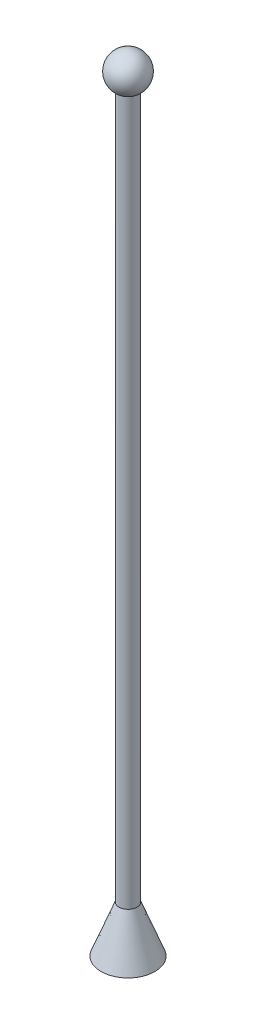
SolidWorks part; units mm, degrees
ref_plane "Front Plane" through (0, 0, 0) normal (0, 0, 1) x (1, 0, 0)
ref_plane "Top Plane" through (0, 0, 0) normal (0, 1, 0) x (1, 0, 0)
ref_plane "Right Plane" through (0, 0, 0) normal (1, 0, 0) x (0, 0, -1)
sketch "Sketch1" plane through (0, 0, 0) normal (0, 1, 0) x (1, 0, 0)
  circle A0 centre (0, 0) radius 19.05
  dimension "D1" = 38.1
ref_plane "Plane1" through (0, 33.02, 0) normal (0, 1, 0) x (-1, 0, 0)
sketch "Sketch2" plane through (0, 33.02, 0) normal (0, 1, 0) x (-1, 0, 0)
  circle A0 centre (0, 0) radius 6.35
  dimension "D1" = 12.7
loft "Loft1" add profiles "Sketch1", "Sketch2"
sketch "Sketch3" plane through (0, 33.02, 0) normal (0, 1, 0) x (1, 0, 0)
  circle A0 centre (0, 0) radius 6.35
  dimension "D1" = 12.7
extrude "Boss-Extrude1" add sketch "Sketch3" along normal blind 508
sketch "Sketch5" plane through (0, 0, 0) normal (1, 0, 0) x (0, 0, -1)
  line L0 (6.35, 541.02) -> (-6.35, 541.02) construction
  line L1 (0, 553.72) -> (0, 528.32)
  arc A0 (0, 528.32) -> (0, 553.72) centre (0, 541.02) ccw
  dimension "D1" = 12.7
ref_axis "Axis1" through (0, 553.72, 0) along (0, -1, 0)
revolve "Revolve1" add sketch "Sketch5" angle 360 about axis through (0, 553.72, 0) along (0, -1, 0)
